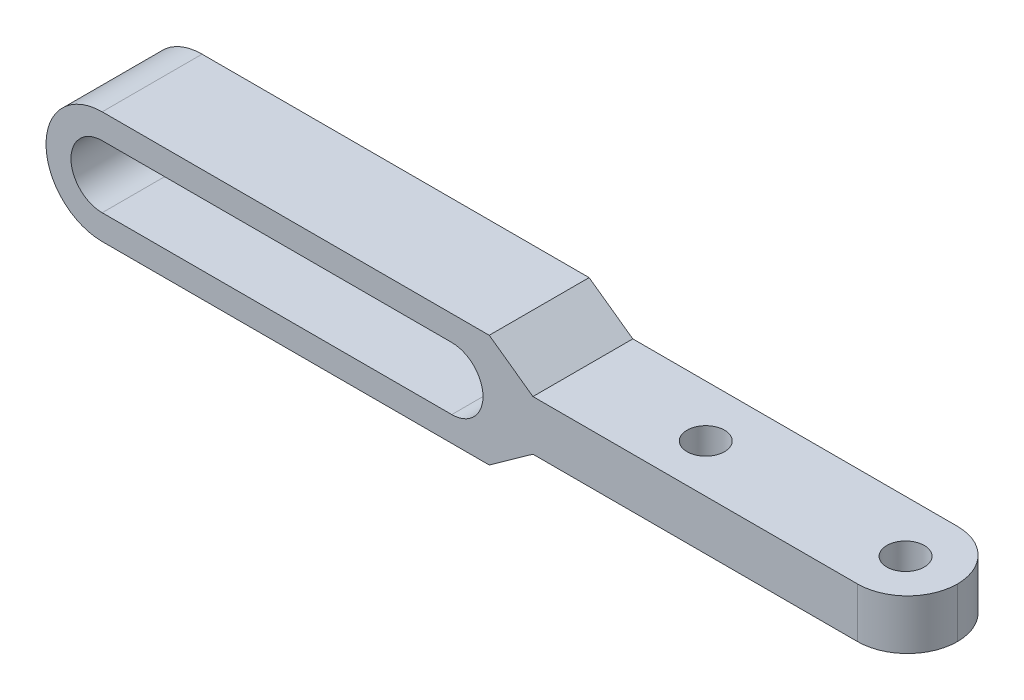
SolidWorks part; units mm, degrees
ref_plane "Front Plane" through (0, 0, 0) normal (0, 0, 1) x (1, 0, 0)
ref_plane "Top Plane" through (0, 0, 0) normal (0, 1, 0) x (1, 0, 0)
ref_plane "Right Plane" through (0, 0, 0) normal (1, 0, 0) x (0, 0, -1)
sketch "Sketch1" plane through (0, 0, 0) normal (0, 0, 1) x (1, 0, 0)
  line L0 (0, 0) -> (60, 0)
  line L1 (60, 0) -> (60, -8)
  line L2 (60, -8) -> (0, -8)
  line L3 (0, 0) -> (-7, 5)
  line L4 (-7, 5) -> (-78, 5)
  line L5 (-78, 5) -> (-78, -13)
  line L6 (-78, -13) -> (-7, -13)
  line L7 (-7, -13) -> (0, -8)
  dimension "D2" = 8
  dimension "D7" = 5
  dimension "D1" = 71
  dimension "D3" = 71
  dimension "D4" = 7
  dimension "D5" = 7
  dimension "D6" = 60
  dimension "D8" = 5
  dimension "D9" = 18
extrude "Boss-Extrude1" add sketch "Sketch1" along normal blind 16 contours L4 L5 L6 L7 L2 L1 L0 L3
sketch "Sketch3" plane through (0, -8, 0) normal (0, -1, 0) x (-1, 0, 0)
  line L0 (0, -16) -> (0, 0) construction
  circle A0 centre (-20, -8.3117) radius 3
  circle A1 centre (-52, -8.3117) radius 3
  dimension "D1" = 6
  dimension "D2" = 32
  dimension "D3" = 20
extrude "Cut-Extrude1" cut sketch "Sketch3" against normal blind 16
sketch "Sketch4" plane through (0, 0, 0) normal (0, 0, -1) x (-1, 0, 0)
  line L0 (69, -4) -> (13, -4) construction
  line L1 (69, -9) -> (13, -9)
  line L2 (69, 1) -> (13, 1)
  line L3 (7, 5) -> (78, 5) construction
  arc A0 (69, -9) -> (69, 1) centre (69, -4) ccw
  arc A1 (13, 1) -> (13, -9) centre (13, -4) ccw
  point P2 (41, -4)
  point P7 (0, 0)
  point P8 (0, 0)
  point P10 (69, -5.5045)
  point P11 (0, 0)
  point P12 (0, 0)
  dimension "D3" = 10
  dimension "D1" = 62
  dimension "D2" = 56
  dimension "D4" = 4
extrude "Cut-Extrude2" cut sketch "Sketch4" against normal blind 16 contours L1 A1 L2 A0
fillet "Fillet1" radius 8 2 edges at (60, -4, 0) (60, -4, 16)
fillet "Fillet3" radius 9 2 edges at (-78, -13, 8) (-78, 5, 8)
